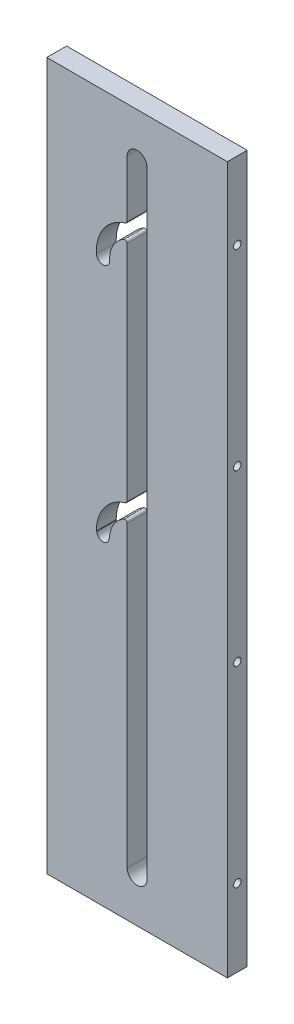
SolidWorks part; units mm, degrees
ref_plane "Front Plane" through (0, 0, 0) normal (0, 0, 1) x (1, 0, 0)
ref_plane "Top Plane" through (0, 0, 0) normal (0, 1, 0) x (1, 0, 0)
ref_plane "Right Plane" through (0, 0, 0) normal (1, 0, 0) x (0, 0, -1)
body saved out of another part "Stock-V1-1"
move or copy body "Body-Move/Copy1" bodies to move or copy 101 copy no rotation origin (-85, 0, 145.5) rotation axis (0, 1, 0) rotation angle 180
sketch "Sketch5" plane through (0, 0, 150) normal (0, 0, 1) x (1, 0, 0)
  line L5 (-85, 309.5) -> (-85, 29.5) construction
  line L6 (-84.75, 309.5) -> (-84.75, 29.5)
  line L7 (-85.25, 309.5) -> (-85.25, 280.748)
  line L8 (-85.25, 280.248) -> (-85.25, 170.748)
  line L9 (-85.25, 170.248) -> (-85.25, 29.5)
  arc A14 (-84.75, 309.5) -> (-85.25, 309.5) centre (-85, 309.5) ccw
  arc A15 (-85.25, 29.5) -> (-84.75, 29.5) centre (-85, 29.5) ccw
  arc A16 (-100.25, 155) -> (-85.25, 170.248) centre (-85, 155) cw
  arc A17 (-100.75, 155) -> (-85.25, 170.748) centre (-85, 155) cw
  arc A18 (-100.25, 155) -> (-100.75, 155) centre (-100.5, 155) cw
  arc A20 (-100.2326, 264.272) -> (-85.25, 280.248) centre (-85, 265) cw
  arc A21 (-100.732, 264.2482) -> (-85.25, 280.748) centre (-85, 265) cw
  arc A22 (-100.2326, 264.272) -> (-100.732, 264.2482) centre (-100.4823, 264.2601) cw
  point P2 (-85, 169.5)
  dimension "D1" = 0.5
other "Move Face1" parameters "D1"=1
